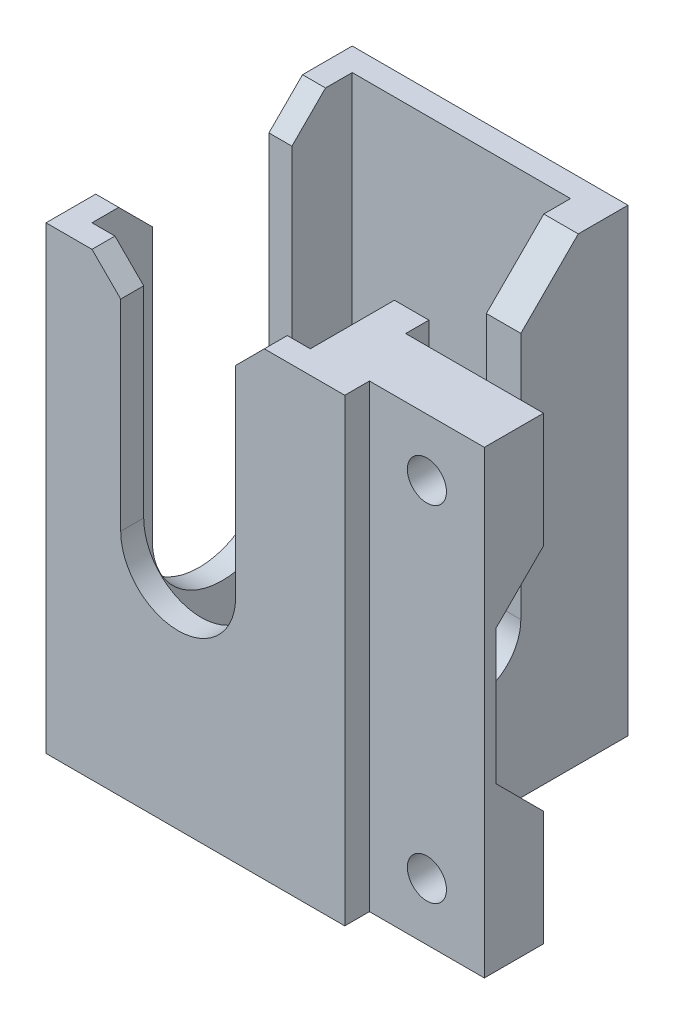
SolidWorks part; units mm, degrees
ref_plane "Front Plane" through (0, 0, 0) normal (0, 0, 1) x (1, 0, 0)
ref_plane "Top Plane" through (0, 0, 0) normal (0, 1, 0) x (1, 0, 0)
ref_plane "Right Plane" through (0, 0, 0) normal (1, 0, 0) x (0, 0, -1)
sketch "Sketch1" plane through (0, 0, 0) normal (0, 1, 0) x (1, 0, 0)
  line L21 (9.5, 11.325) -> (-9.5, 11.325)
  line L22 (-9.5, 11.325) -> (-9.5, -11.325)
  line L23 (-9.5, -11.325) -> (9.5, -11.325)
  line L24 (9.5, -11.325) -> (9.5, 11.325)
  line L25 (-14.5, -13.325) -> (11.5, -13.325)
  line L26 (11.5, -13.325) -> (11.5, 13.325)
  line L27 (11.5, 13.325) -> (-12.5, 13.325)
  line L28 (-12.5, 13.325) -> (-12.5, -6.025)
  line L29 (-12.5, -6.025) -> (-24.5, -6.025)
  line L30 (-24.5, -6.025) -> (-24.5, -11.175)
  line L31 (-24.5, -11.175) -> (-14.5, -11.175)
  line L32 (-14.5, -11.175) -> (-14.5, -13.325)
  line L33 (0, -11.325) -> (0, 11.325) construction
  point P31 (0, 0)
  dimension "D1" = 19
  dimension "D2" = 22.65
  dimension "D3" = 2
  dimension "D4" = 2
  dimension "D5" = 2
  dimension "D6" = 3
  dimension "D7" = 2
  dimension "D8" = 10
  dimension "D9" = 2.15
  dimension "D10" = 5.15
extrude "Boss-Extrude1" add sketch "Sketch1" along normal blind 40
sketch "Sketch2" plane through (0, 0, 0) normal (0, -1, 0) x (1, 0, 0)
  line L5 (-1.73, 2.75) -> (-1.73, -2.75)
  line L6 (-1.73, -2.75) -> (1.73, -2.75)
  line L7 (1.73, -2.75) -> (1.73, 2.75)
  line L8 (-14.5, 13.325) -> (-14.5, 11.175)
  line L9 (-14.5, 11.175) -> (-24.5, 11.175)
  line L10 (-24.5, 11.175) -> (-24.5, 6.025)
  line L11 (-24.5, 6.025) -> (-12.5, 6.025)
  line L12 (-12.5, 6.025) -> (-12.5, -13.325)
  line L13 (-12.5, -13.325) -> (11.5, -13.325)
  line L14 (11.5, -13.325) -> (11.5, 13.325)
  line L15 (11.5, 13.325) -> (-14.5, 13.325)
  line L16 (-14.5, 13.325) -> (-14.5, 11.175)
  line L17 (-14.5, 11.175) -> (-24.5, 11.175)
  line L18 (-24.5, 11.175) -> (-24.5, 6.025)
  line L19 (-24.5, 6.025) -> (-12.5, 6.025)
  line L20 (-12.5, 6.025) -> (-12.5, -13.325)
  line L21 (-12.5, -13.325) -> (11.5, -13.325)
  line L22 (11.5, -13.325) -> (11.5, 13.325)
  line L23 (11.5, 13.325) -> (-14.5, 13.325)
  line L24 (1.73, 2.75) -> (-1.73, 2.75)
  line L25 (0, -2.75) -> (0, 2.75) construction
  point P22 (0, 0)
  dimension "D2" = 3.46
  dimension "D3" = 5.5
  dimension "D1" = 0
extrude "Boss-Extrude2" add sketch "Sketch2" against normal blind 2
sketch "Sketch3" plane through (-12.5, 0, 0) normal (-1, 0, 0) x (0, 0, 1)
  line L0 (0, 46.446) -> (0, 13.43) construction
  line L1 (4, 46.446) -> (4, 13.43)
  line L2 (-4, 46.446) -> (-4, 13.43)
  line L3 (-13.325, 40) -> (6.025, 40) construction
  arc A0 (4, 46.446) -> (-4, 46.446) centre (0, 46.446) ccw
  arc A1 (-4, 13.43) -> (4, 13.43) centre (0, 13.43) ccw
  point P3 (0, 29.938)
  dimension "D1" = 8
  dimension "D2" = 26.57
extrude "Cut-Extrude1" cut sketch "Sketch3" against normal blind 3
sketch "Sketch4" plane through (9.5, 0, 0) normal (-1, 0, 0) x (0, 0, 1)
  line L0 (0, 43.3627) -> (0, 13.43) construction
  line L1 (6.075, 43.3627) -> (6.075, 13.43)
  line L2 (-6.075, 43.3627) -> (-6.075, 13.43)
  arc A0 (6.075, 43.3627) -> (-6.075, 43.3627) centre (0, 43.3627) ccw
  arc A1 (-6.075, 13.43) -> (6.075, 13.43) centre (0, 13.43) ccw
  point P3 (0, 28.3963)
  dimension "D1" = 12.15
extrude "Cut-Extrude2" cut sketch "Sketch4" against normal blind 2
sketch "Sketch5" plane through (0, 0, 13.325) normal (0, 0, 1) x (1, 0, 0)
  line L1 (-14.5, 40) -> (11.5, 40) construction
  line L2 (0, 47.9306) -> (0, 20) construction
  line L3 (5, 47.9306) -> (5, 20)
  line L4 (-5, 47.9306) -> (-5, 20)
  arc A0 (5, 47.9306) -> (-5, 47.9306) centre (0, 47.9306) ccw
  arc A1 (-5, 20) -> (5, 20) centre (0, 20) ccw
  point P5 (0, 33.9653)
  dimension "D1" = 10
  dimension "D2" = 20
extrude "Cut-Extrude3" cut sketch "Sketch5" against normal blind 2
sketch "Sketch7" plane through (-24.5, 0, 0) normal (-1, 0, 0) x (0, 0, 1)
  line L0 (6.025, 30) -> (10.175, 25.85)
  line L1 (6.025, 40) -> (6.025, 0) construction
  line L2 (10.175, 25.85) -> (10.175, 14.15)
  line L3 (10.175, 14.15) -> (6.025, 10)
  line L4 (6.025, 40) -> (11.175, 40) construction
  line L5 (6.025, 0) -> (11.175, 0) construction
  line L6 (11.175, 40) -> (11.175, 0) construction
  line L7 (6.025, 10) -> (6.025, 30)
  dimension "D1" = 45
  dimension "D2" = 45
  dimension "D3" = 10
  dimension "D4" = 10
  dimension "D5" = 1
extrude "Cut-Extrude4" cut sketch "Sketch7" against normal up to surface (12 mm away)
sketch "Sketch8" plane through (0, 0, 6.025) normal (0, 0, -1) x (-1, 0, 0)
  line L0 (24.5, 10) -> (14.5, 10) construction
  line L1 (12.5, 10) -> (24.5, 10) construction
  line L2 (14.5, 10) -> (24.5, 0) construction
  line L3 (12.5, 10) -> (12.5, 0) construction
  line L4 (24.5, 20) -> (33.6538, 20) construction
  line L5 (24.5, 14.15) -> (24.5, 25.85) construction
  circle A0 centre (19.5, 5) radius 2.1465
  circle A1 centre (19.5, 35) radius 2.1465
  dimension "D1" = 2
hole_wizard "CBORE for M3 Pan Head Machine Screw1" positions "Sketch9" profile "Sketch10" counterbore size "M3" standard "ANSI Metric"
sketch "Sketch9" plane through (0, 0, 6.025) normal (0, 0, -1) x (-1, 0, 0)
  point P0 (19.5, 35)
  point P3 (19.5, 5)
sketch "Sketch10" plane through (-19.5, 35, 6.025) normal (1, 0, 0) x (0, 1, 0)
  line L0 (0, 0) -> (0, 16)
  line L1 (0, 16) -> (1.7, 14.9785)
  line L2 (1.7, 14.9785) -> (1.7, 2.4)
  line L3 (1.7, 2.4) -> (3.5, 2.4)
  line L4 (3.5, 2.4) -> (3.5, 0)
  line L5 (3.5, 0) -> (0, 0)
  line L10 (0, 16) -> (-1.7, 14.9785) construction
  line L11 (0, -6.35) -> (0, 107.95) construction
  dimension "Hole Dia." = 3.4
  dimension "Hole Depth" = 16
  dimension "C'Bore Dia." = 7
  dimension "C'Bore Depth" = 2.4
  dimension "Drill Angle" = 118
sketch "Sketch11" plane through (0, 0, -13.325) normal (0, 0, -1) x (-1, 0, 0)
  line L0 (0, 0) -> (0, 40) construction
  line L1 (-11.5, 40) -> (12.5, 40) construction
  circle A0 centre (0, 20) radius 1.7
  circle A1 centre (19.5, 35) radius 1.7 construction
extrude "Cut-Extrude5" cut sketch "Sketch11" against normal up to surface (2 mm away)
chamfer "Chamfer2" distance 5 angle 45 1 edges at (-11, 40, -4)
sketch "Sketch12" plane through (11.5, 0, 0) normal (1, 0, 0) x (0, 0, -1)
  line L0 (4, 35) -> (9, 40)
  line L1 (9, 40) -> (4, 40)
  line L2 (4, 40) -> (4, 35)
  line L4 (0, 0) -> (0, 46.0624) construction
  line L5 (-4, 40) -> (-4, 35)
  line L6 (-9, 40) -> (-4, 40)
  line L7 (-4, 35) -> (-9, 40)
extrude "Cut-Extrude6" cut sketch "Sketch12" against normal up to surface (2 mm away)
chamfer "Chamfer3" distance 2.5 angle 45 2 edges at (-5, 40, 12.325) (5, 40, 12.325)
mirror "Mirror1" about plane through (11.5, 40, 13.325) normal (-1, 0, 0)
delete or keep bodies "Body-Delete/Keep 1" type delete bodies bodies 109
